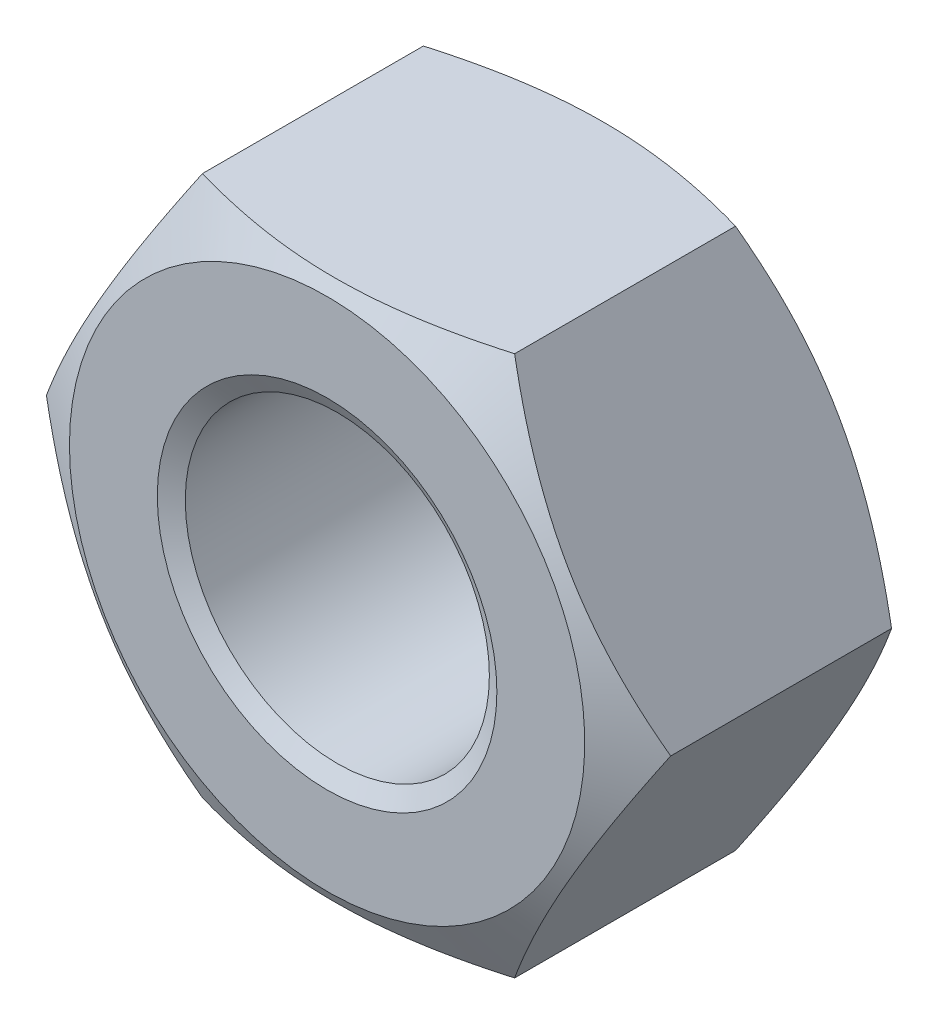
SolidWorks part; units mm, degrees
ref_plane "Front" through (0, 0, 0) normal (0, 0, 1) x (1, 0, 0)
ref_plane "Top" through (0, 0, 0) normal (0, 1, 0) x (1, 0, 0)
ref_plane "Right" through (0, 0, 0) normal (1, 0, 0) x (0, 0, -1)
sketch "Sketch1" plane through (0, 0, 0) normal (0, 0, 1) x (1, 0, 0)
  line L1 (4.6188, -8) -> (9.2376, 0)
  line L2 (9.2376, 0) -> (4.6188, 8)
  line L3 (4.6188, 8) -> (-4.6188, 8)
  line L4 (-4.6188, 8) -> (-9.2376, 0)
  line L5 (-9.2376, 0) -> (-4.6188, -8)
  line L6 (-4.6188, -8) -> (4.6188, -8)
  circle A0 centre (0, 0) radius 8 construction
  circle A1 centre (0, 0) radius 4.5
  dimension "D" = 9
  dimension "s" = 16
extrude "BaseNut" add sketch "Sketch1" against normal blind 8.4
sketch "Sketch2" plane through (0, 0, 0) normal (0, 1, 0) x (1, 0, 0)
  line L0 (-9.2376, 8.4) -> (-7.625, 8.4)
  line L2 (-7.625, 8.4) -> (-9.2376, 7.469)
  line L3 (-9.2376, 7.469) -> (-9.2376, 8.4)
  line L4 (0, 9.8171) -> (0, -9.8171) construction
  line L6 (-9.7712, 4.2) -> (9.8853, 4.2) construction
  line L7 (-9.2376, 0.931) -> (-9.2376, 0)
  line L8 (-7.625, 0) -> (-9.2376, 0.931)
  line L9 (-9.2376, 0) -> (-7.625, 0)
  dimension "D1" = 30
  dimension "dw" = 15.25
  dimension "D2" = 4.2
revolve "Double-Chamfer" cut sketch "Sketch2" angle 360 about L4
chamfer "EndChamfer" distance 0.525 angle 30 2 edges at (4.5, 0, -8.4) (4.5, 0, 0)
sketch "Sketch3" plane through (0, 0, 0) normal (0, 1, 0) x (1, 0, 0)
  line L0 (-4.933, 7.875) -> (-4.5, 7.625)
  line L1 (-4.5, 7.625) -> (-4, 7.625)
  line L2 (-4, 7.625) -> (-4, 8.125)
  line L3 (-4, 8.125) -> (-4.5, 8.125)
  line L4 (-4.5, 8.125) -> (-4.933, 7.875)
  line L5 (0, 5.5171) -> (0, 12.3415) construction
  dimension "D1" = 0.5
  dimension "D2" = 9
revolve "Cut-Revolve10" [suppressed] cut sketch "Sketch3" angle 360 about L5
pattern_linear "LPattern10" [suppressed] count 13 spacing 0.6 along (0, 0, -1)
equation "\"dw@Sketch2\" = \"s@Sketch1\"-0.75"
equation "\"D1@EndChamfer\" = \"m@BaseNut\" / 16"
equation "\"D2@Sketch2\" = \"m@BaseNut\" / 2"
equation "\"D2@Sketch3\"=\"D@Sketch1\""
equation "\"D1@Sketch3\" =  ( \"D@ThreadCosmetic1\" - \"D@Sketch1\" )  / 2"
equation "\"D3@LPattern10\"=\"D1@Sketch3\" * 1.2"
equation "\"D1@LPattern10\" = \"m@BaseNut\" / \"D3@LPattern10\"-1"
